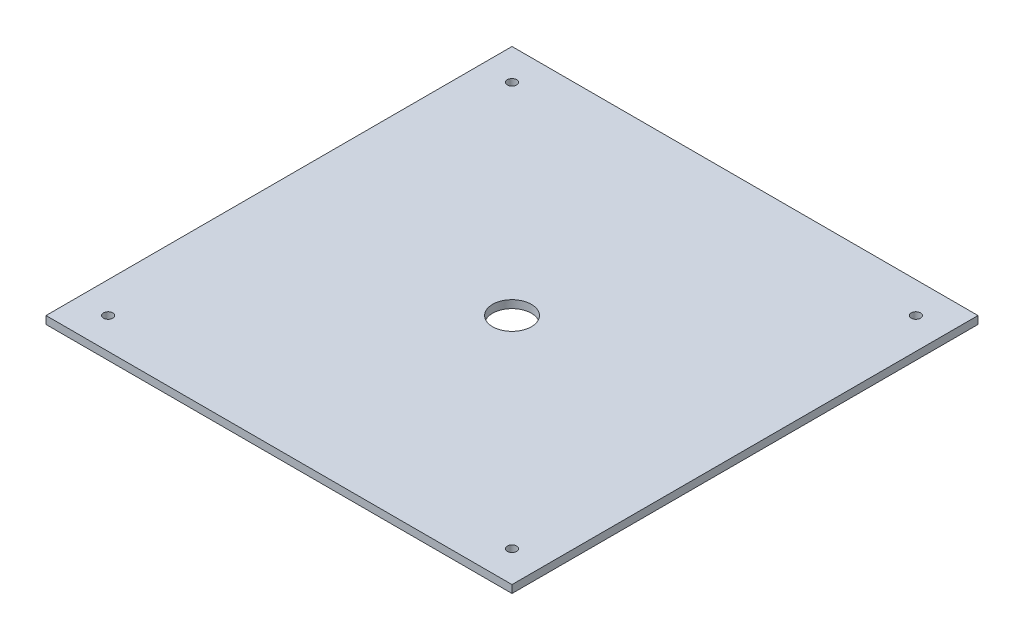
SolidWorks part; units mm, degrees
ref_plane "Front Plane" through (0, 0, 0) normal (0, 0, 1) x (1, 0, 0)
ref_plane "Top Plane" through (0, 0, 0) normal (0, 1, 0) x (1, 0, 0)
ref_plane "Right Plane" through (0, 0, 0) normal (1, 0, 0) x (0, 0, -1)
sketch "Sketch1" plane through (0, 0, 0) normal (0, 1, 0) x (1, 0, 0)
  line L1 (0, 0) -> (300, 0)
  line L2 (0, 0) -> (0, 300)
  line L3 (0, 300) -> (300, 300)
  line L4 (300, 0) -> (300, 300)
  dimension "D1" = 300
  dimension "D2" = 300
extrude "Boss-Extrude1" add sketch "Sketch1" along normal blind 5
sketch "Sketch2" plane through (0, 5, 0) normal (0, 1, 0) x (1, 0, 0)
  line L0 (0, 300) -> (0, 0) construction
  line L1 (300, 300) -> (0, 300) construction
  line L2 (150, 300) -> (150, 0) construction
  line L3 (0, 0) -> (300, 0) construction
  line L4 (0, 150) -> (300, 150) construction
  line L5 (300, 0) -> (300, 300) construction
  circle A0 centre (20, 280) radius 3
  circle A1 centre (20, 20) radius 3
  circle A2 centre (280, 20) radius 3
  circle A3 centre (280, 280) radius 3
  dimension "D1" = 6
  dimension "D2" = 20
  dimension "D3" = 20
extrude "Cut-Extrude1" cut sketch "Sketch2" against normal blind 5
sketch "Sketch3" plane through (0, 5, 0) normal (0, 1, 0) x (1, 0, 0)
  line L0 (0, 300) -> (0, 0) construction
  circle A0 centre (150, 150) radius 12.5
  point P4 (0, 150)
  dimension "D1" = 25
extrude "Cut-Extrude2" cut sketch "Sketch3" against normal up to surface (5 mm away)
